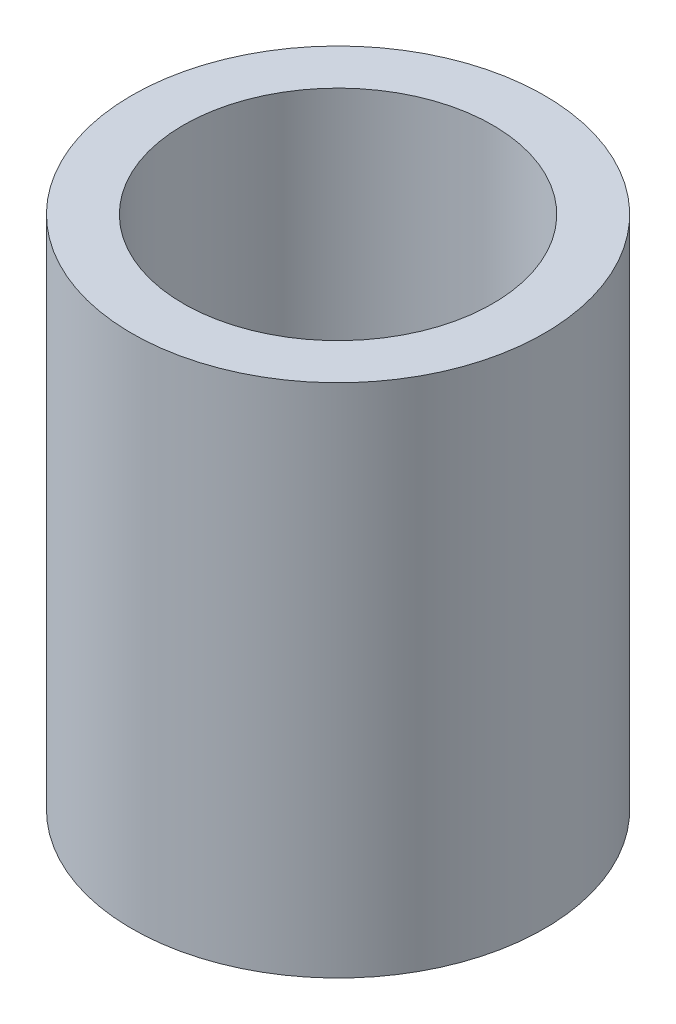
SolidWorks part; units mm, degrees
ref_plane "Plan1" through (0, 0, 0) normal (0, 0, 1) x (1, 0, 0)
ref_plane "Plan2" through (0, 0, 0) normal (0, 1, 0) x (1, 0, 0)
ref_plane "Plan3" through (0, 0, 0) normal (1, 0, 0) x (0, 0, -1)
sketch "Esquisse1" plane through (0, 0, 0) normal (0, 0, 1) x (1, 0, 0)
  line L0 (0, 83.539) -> (0, -27.6846) construction
  line L1 (0, -50) -> (0, 50) construction
  line L2 (50, 0) -> (-50, 0) construction
  line L3 (15, 50) -> (20, 50)
  line L4 (15, 50) -> (15, 0)
  line L5 (15, 0) -> (20, 0)
  line L6 (20, 50) -> (20, 0)
  dimension "D1" = 30
  dimension "D2" = 40
  dimension "D3" = 50
revolve "Révolution1" add sketch "Esquisse1" angle 360 about L0
